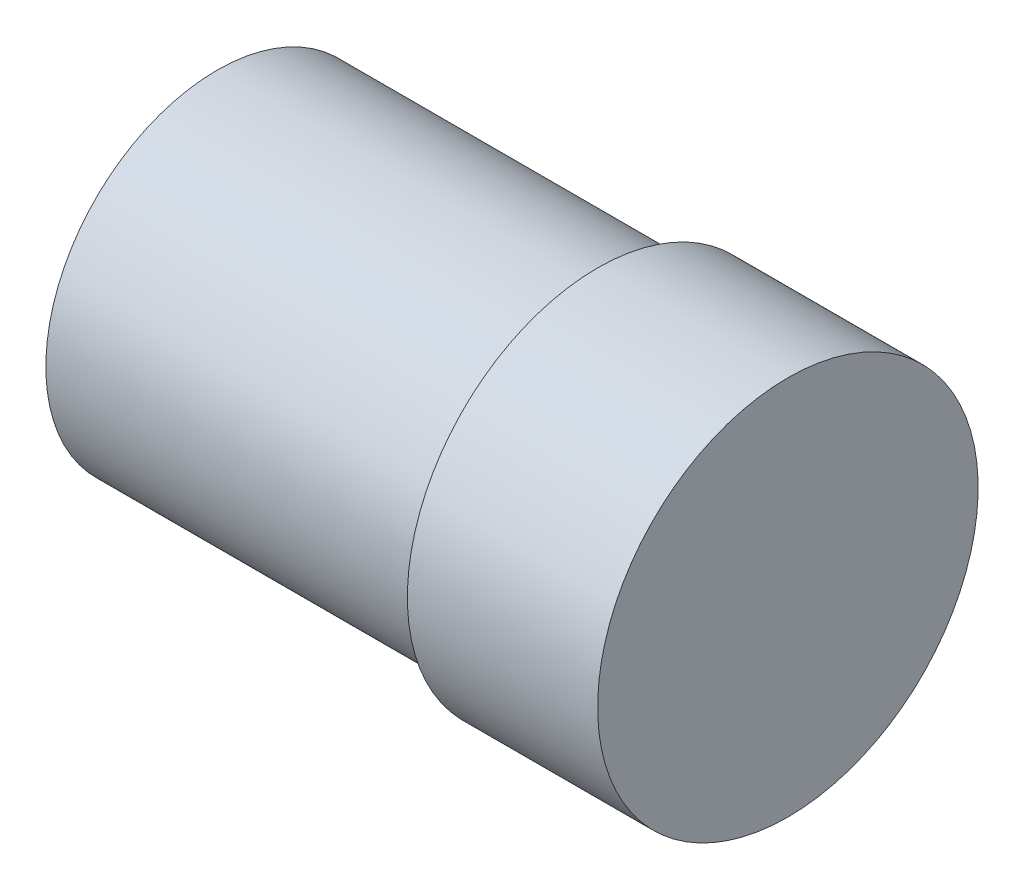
SolidWorks part; units mm, degrees
ref_plane "Vorne" through (0, 0, 0) normal (0, 0, 1) x (1, 0, 0)
ref_plane "Oben" through (0, 0, 0) normal (0, 1, 0) x (1, 0, 0)
ref_plane "Rechts" through (0, 0, 0) normal (1, 0, 0) x (0, 0, -1)
sketch "Skizze1" plane through (0, 0, 0) normal (0, 0, 1) x (1, 0, 0)
  line L0 (0, 0) -> (0, 4.5)
  line L1 (0, 4.5) -> (10, 4.5)
  line L2 (10, 4.5) -> (10, 5)
  line L3 (10, 5) -> (15, 5)
  line L4 (15, 5) -> (15, 0)
  line L5 (15, 0) -> (0, 0)
  dimension "D1" = 4.5
  dimension "D2" = 5
  dimension "D3" = 15
  dimension "D4" = 5
revolve "Rotation1" add sketch "Skizze1" angle 360 about L5
